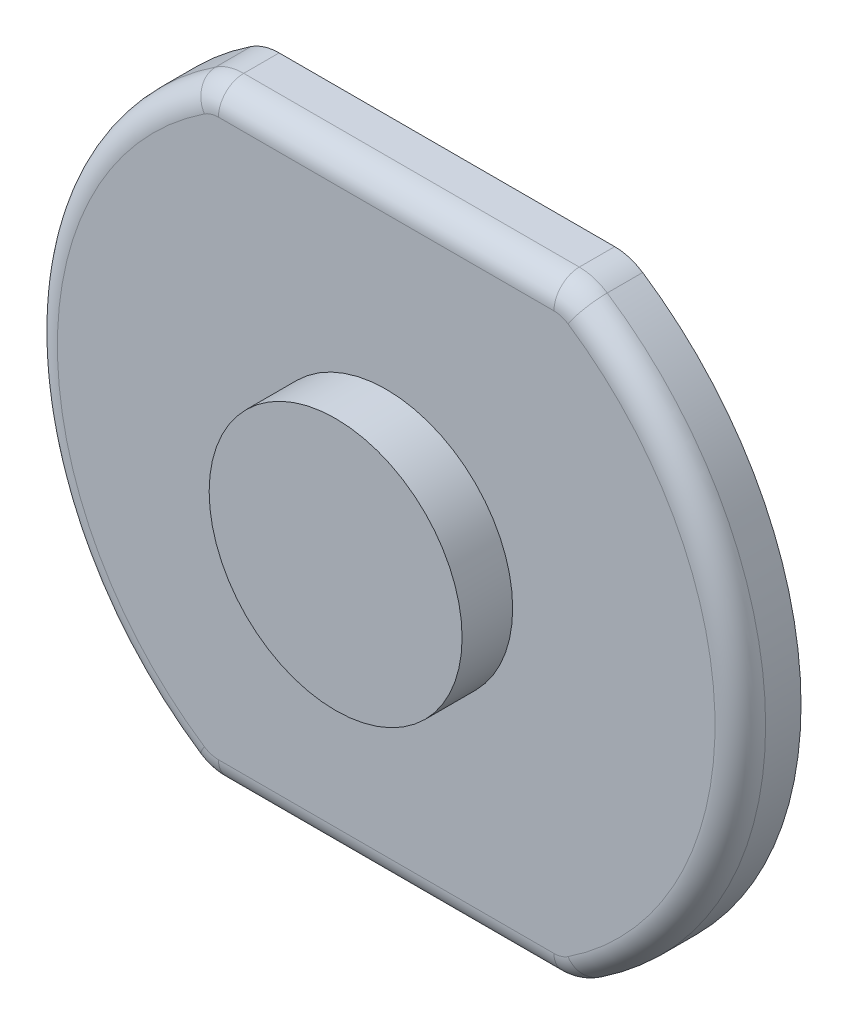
SolidWorks part; units mm, degrees
ref_plane "Plan de face" through (0, 0, 0) normal (0, 0, 1) x (1, 0, 0)
ref_plane "Plan de dessus" through (0, 0, 0) normal (0, 1, 0) x (1, 0, 0)
ref_plane "Plan de droite" through (0, 0, 0) normal (1, 0, 0) x (0, 0, -1)
sketch "Esquisse1" plane through (0, 0, 0) normal (0, 0, 1) x (1, 0, 0)
  line L2 (-3.3166, -6) -> (3.3166, -6)
  line L3 (3.3166, 6) -> (-3.3166, 6)
  line L4 (-3.3166, -6) -> (3.3166, -6)
  line L5 (3.3166, 6) -> (-3.3166, 6)
  arc A6 (-3.8694, -5.8333) -> (-3.3166, -6) centre (-3.3166, -5) ccw
  arc A7 (3.3166, -6) -> (3.8694, -5.8333) centre (3.3166, -5) ccw
  arc A8 (3.8694, -5.8333) -> (3.8694, 5.8333) centre (0, 0) ccw
  arc A9 (3.8694, 5.8333) -> (3.3166, 6) centre (3.3166, 5) ccw
  arc A10 (-3.3166, 6) -> (-3.8694, 5.8333) centre (-3.3166, 5) ccw
  arc A11 (-3.8694, 5.8333) -> (-3.8694, -5.8333) centre (0, 0) ccw
  arc A12 (-3.8694, -5.8333) -> (-3.3166, -6) centre (-3.3166, -5) ccw
  arc A13 (3.3166, -6) -> (3.8694, -5.8333) centre (3.3166, -5) ccw
  arc A14 (3.8694, -5.8333) -> (3.8694, 5.8333) centre (0, 0) ccw
  arc A15 (3.8694, 5.8333) -> (3.3166, 6) centre (3.3166, 5) ccw
  arc A16 (-3.3166, 6) -> (-3.8694, 5.8333) centre (-3.3166, 5) ccw
  arc A17 (-3.8694, 5.8333) -> (-3.8694, -5.8333) centre (0, 0) ccw
  dimension "D1" = 0
extrude "Extrusion1" add sketch "Esquisse1" along normal blind 1.2
fillet "Congé1" radius 0.5 8 edges at (-3.6053, 5.9574, 1.2) (0, 6, 1.2) (3.6053, 5.9574, 1.2) (7, 0, 1.2) (3.6053, -5.9574, 1.2) (0, -6, 1.2) (-3.6053, -5.9574, 1.2) (-7, 0, 1.2)
sketch "Esquisse2" plane through (0, 0, 1.2) normal (0, 0, 1) x (1, 0, 0)
  circle A0 centre (0, 0) radius 2.5
  dimension "D1" = 5
extrude "Extrusion2" add sketch "Esquisse2" along normal blind 1
